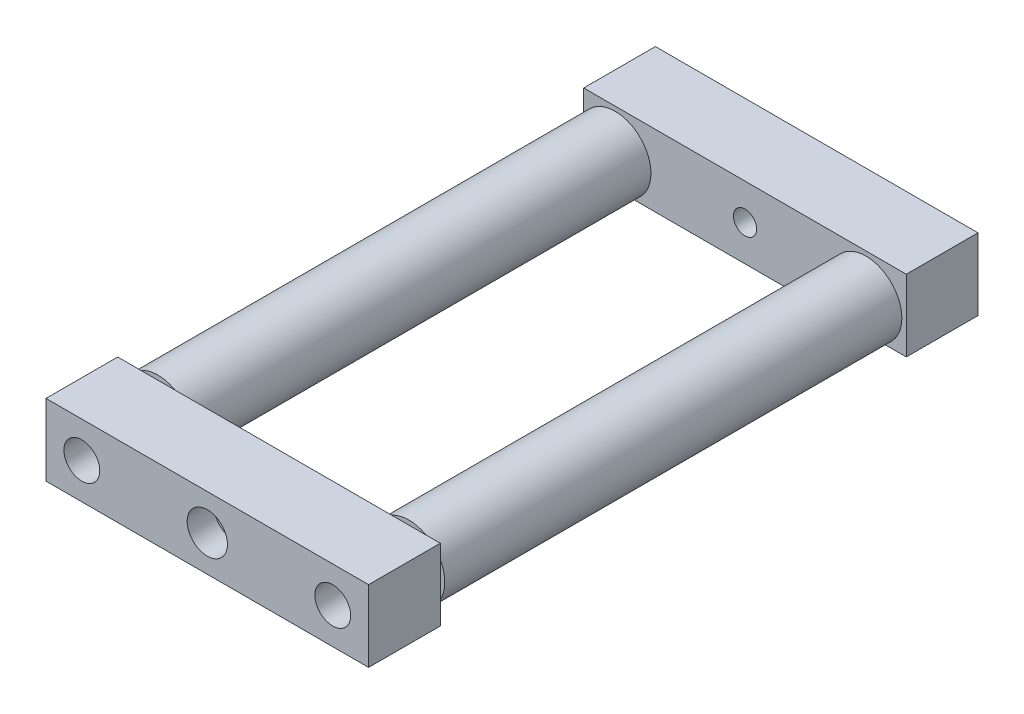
SolidWorks part; units mm, degrees
ref_plane "Front Plane" through (0, 0, 0) normal (0, 0, 1) x (1, 0, 0)
ref_plane "Top Plane" through (0, 0, 0) normal (0, 1, 0) x (1, 0, 0)
ref_plane "Right Plane" through (0, 0, 0) normal (1, 0, 0) x (0, 0, -1)
sketch "Sketch1" plane through (0, 0, 0) normal (0, 0, 1) x (1, 0, 0)
  line L0 (0, 0) -> (22.225, 0) construction
  line L1 (0, 0) -> (-22.225, 0) construction
  line L2 (-15.875, 17.8385) -> (-15.875, -21.0214) construction
  line L3 (15.875, 17.8385) -> (15.875, -21.0214) construction
  line L4 (0, 0) -> (0, 20.034) construction
  line L5 (-28.575, -6.35) -> (28.575, -6.35)
  line L6 (28.575, -6.35) -> (28.575, 6.35)
  line L7 (28.575, 6.35) -> (-28.575, 6.35)
  line L8 (-28.575, 6.35) -> (-28.575, -6.35)
  circle A0 centre (-22.225, 0) radius 3.175
  circle A1 centre (22.225, 0) radius 3.175
  circle A2 centre (-22.225, 0) radius 6.35
  circle A3 centre (22.225, 0) radius 6.35
  circle A4 centre (0, 0) radius 2.0574
  circle A5 centre (0, 0) radius 3.5687
  dimension "D1" = 6.35
  dimension "D4" = 12.7
  dimension "D7" = 4.1148
  dimension "D8" = 7.1374
  dimension "D2" = 44.45
  dimension "D3" = 31.75
  dimension "D5" = 57.15
  dimension "D6" = 12.7
sketch "Sketch2" plane through (0, 0, 0) normal (0, 0, 1) x (1, 0, 0)
  line L0 (-28.575, -6.35) -> (28.575, -6.35) construction
  line L1 (28.575, -6.35) -> (28.575, 6.35) construction
  line L2 (28.575, 6.35) -> (-28.575, 6.35) construction
  line L3 (-28.575, 6.35) -> (-28.575, -6.35) construction
  line L4 (-28.575, -6.35) -> (28.575, -6.35)
  line L5 (28.575, -6.35) -> (28.575, 6.35)
  line L6 (28.575, 6.35) -> (-28.575, 6.35)
  line L7 (-28.575, 6.35) -> (-28.575, -6.35)
  circle A0 centre (-22.225, 0) radius 3.175 construction
  circle A1 centre (22.225, 0) radius 3.175 construction
  circle A2 centre (-22.225, 0) radius 3.175
  circle A3 centre (22.225, 0) radius 3.175
extrude "Boss-Extrude1" add sketch "Sketch2" along normal blind 12.7 from offset 41.275
sketch "Sketch3" plane through (0, 0, 0) normal (0, 0, 1) x (1, 0, 0)
  line L0 (-28.575, -6.35) -> (28.575, -6.35) construction
  line L1 (28.575, -6.35) -> (28.575, 6.35) construction
  line L2 (28.575, 6.35) -> (-28.575, 6.35) construction
  line L3 (-28.575, 6.35) -> (-28.575, -6.35) construction
  line L4 (-28.575, -6.35) -> (28.575, -6.35)
  line L5 (28.575, -6.35) -> (28.575, 6.35)
  line L6 (28.575, 6.35) -> (-28.575, 6.35)
  line L7 (-28.575, 6.35) -> (-28.575, -6.35)
  circle A0 centre (-22.225, 0) radius 3.175 construction
  circle A1 centre (22.225, 0) radius 3.175 construction
  circle A2 centre (-22.225, 0) radius 3.175
  circle A3 centre (22.225, 0) radius 3.175
extrude "Boss-Extrude2" add sketch "Sketch3" against normal blind 12.7 from offset 41.275 separate body
sketch "Sketch4" plane through (0, 0, 0) normal (0, 0, 1) x (1, 0, 0)
  circle A0 centre (-22.225, 0) radius 6.35 construction
  circle A1 centre (-22.225, 0) radius 3.175 construction
  circle A2 centre (22.225, 0) radius 6.35 construction
  circle A3 centre (22.225, 0) radius 3.175 construction
  circle A4 centre (-22.225, 0) radius 6.35
  circle A5 centre (-22.225, 0) radius 3.175
  circle A6 centre (22.225, 0) radius 6.35
  circle A7 centre (22.225, 0) radius 3.175
extrude "Boss-Extrude3" add sketch "Sketch4" along normal mid plane 80.9752 separate body
sketch "Sketch5" plane through (0, 0, 0) normal (0, 0, 1) x (1, 0, 0)
  circle A0 centre (0, 0) radius 2.0574 construction
  circle A1 centre (0, 0) radius 2.0574
extrude "Cut-Extrude1" cut sketch "Sketch5" against normal mid plane 101.6
sketch "Sketch6" plane through (0, 0, 0) normal (0, 0, 1) x (1, 0, 0)
  circle A0 centre (0, 0) radius 3.5687 construction
  circle A1 centre (0, 0) radius 3.5687
extrude "Cut-Extrude2" cut sketch "Sketch6" along normal blind 25.4 from offset 49.2252
sketch "Sketch7" plane through (0, 0, 0) normal (0, 0, 1) x (1, 0, 0)
  circle A0 centre (0, 0) radius 3.5687 construction
  circle A1 centre (0, 0) radius 3.5687
extrude "Cut-Extrude3" cut sketch "Sketch7" against normal blind 25.4 from offset 49.2252
